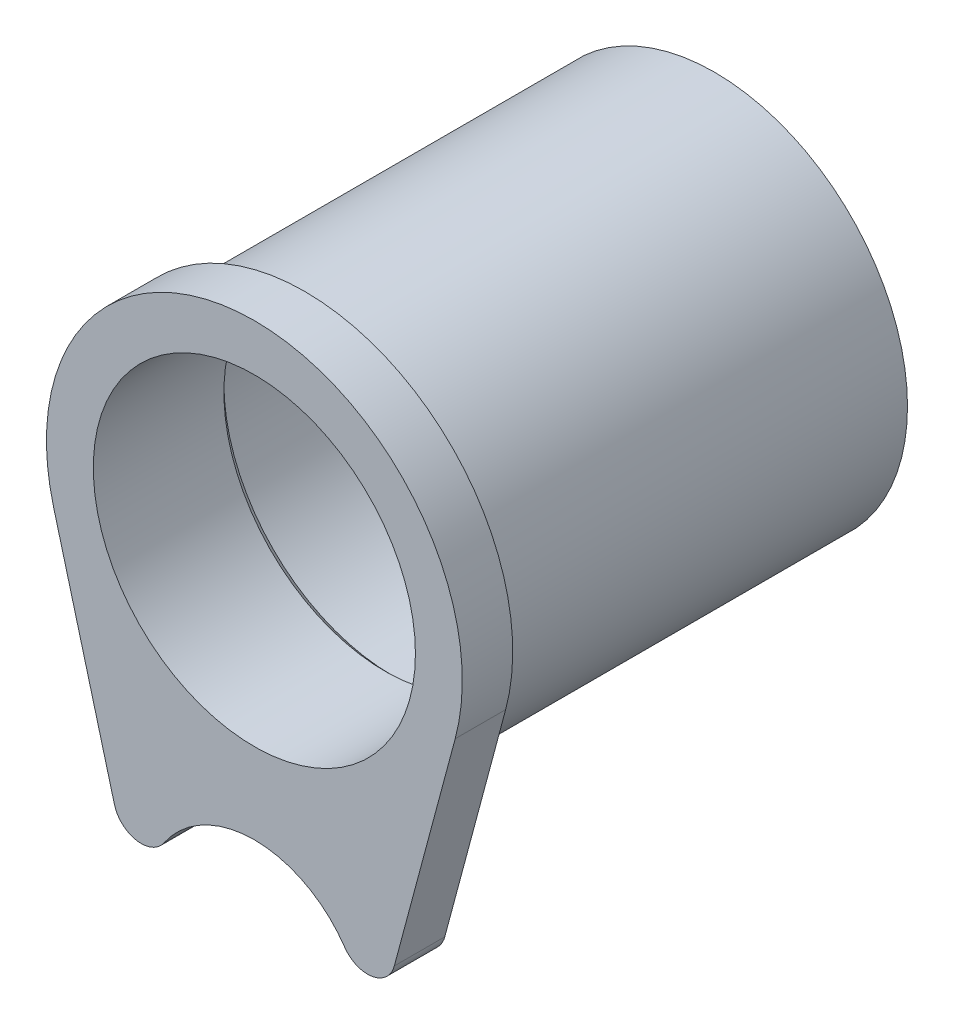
SolidWorks part; units mm, degrees
ref_plane "Front Plane" through (0, 0, 0) normal (0, 0, 1) x (1, 0, 0)
ref_plane "Top Plane" through (0, 0, 0) normal (0, 1, 0) x (1, 0, 0)
ref_plane "Right Plane" through (0, 0, 0) normal (1, 0, 0) x (0, 0, -1)
sketch "Sketch1" plane through (0, 0, 0) normal (0, 0, 1) x (1, 0, 0)
  circle A0 centre (0, 0) radius 8.8392
  dimension "D1" = 17.6784
extrude "Boss-Extrude1" add sketch "Sketch1" against normal blind 21.082
sketch "Sketch2" plane through (0, 0, -21.082) normal (0, 0, -1) x (-1, 0, 0)
  circle A0 centre (0, 0) radius 7.747
  dimension "D1" = 15.494
extrude "Cut-Extrude1" cut sketch "Sketch2" against normal blind 14.732
sketch "Sketch3" plane through (0, 0, -6.35) normal (0, 0, -1) x (-1, 0, 0)
  circle A0 centre (0, 0) radius 7.3787
  dimension "D1" = 14.7574
extrude "Cut-Extrude2" cut sketch "Sketch3" against normal blind 14.732
sketch "Sketch4" plane through (0, 0, 0) normal (0, 0, 1) x (1, 0, 0)
  line L0 (0, 13.4567) -> (0, -21.1312) construction
  line L1 (9.861, 0) -> (-13.8788, 0) construction
  line L2 (-9.2004, -2.4653) -> (-6.4114, -12.8742)
  line L3 (6.4114, -12.8742) -> (9.2004, -2.4653)
  line L4 (-12.7089, -11.0744) -> (-6.8936, -11.0744) construction
  line L5 (6.8936, -11.0744) -> (9.0775, -11.0744) construction
  arc A0 (9.2004, -2.4653) -> (-9.2004, -2.4653) centre (0, 0) ccw
  arc A1 (4.1351, -13.2606) -> (-4.1351, -13.2606) centre (0, -16.0782) ccw
  arc A2 (-6.4114, -12.8742) -> (-4.1351, -13.2606) centre (-5.1846, -12.5455) ccw
  arc A3 (4.1351, -13.2606) -> (6.4114, -12.8742) centre (5.1846, -12.5455) ccw
  circle A4 centre (0, 0) radius 7.3787
  dimension "D1" = 19.05
  dimension "D4" = 10.0076
  dimension "D5" = 2.54
  dimension "D2" = 30
  dimension "D3" = 11.0744
extrude "Boss-Extrude2" add sketch "Sketch4" against normal blind 2.3114
sketch "Sketch5" plane through (0, 0, 0) normal (1, 0, 0) x (0, 0, -1)
  line L0 (6.35, -7.747) -> (6.35, 7.747) construction
  line L1 (6.35, -7.747) -> (6.35, -7.3787)
  line L2 (0, -7.3787) -> (6.35, -7.3787) construction
  line L3 (5.9817, -7.3787) -> (6.35, -7.3787)
  line L4 (6.35, -7.747) -> (5.9817, -7.3787)
  line L5 (0, 0) -> (12.8494, 0) construction
revolve "Cut-Revolve1" cut sketch "Sketch5" angle 360 about L5
fillet "Fillet1" radius 0.381 1 edges at (8.8392, 0, -2.3114)
sketch "Sketch6" plane through (0, 0, -2.3114) normal (0, 0, -1) x (-1, 0, 0)
  line L0 (0, 0) -> (0, -20.404) construction
  line L1 (0, 0) -> (9.7596, -2.4333) construction
  line L2 (0, 0) -> (2.9744, -16.8689) construction
  line L3 (9.2004, -2.4653) -> (6.4114, -12.8742) construction
  line L4 (8.5549, -4.8746) -> (8.3639, -5.5871)
  arc A0 (8.5766, -2.1384) -> (8.5549, -4.8746) centre (14.2451, -3.5517) ccw
  arc A1 (4.5512, -8.9698) -> (1.5349, -8.7049) centre (2.5494, -14.4582) ccw
  circle A2 centre (0, 0) radius 8.8392 construction
  arc A3 (1.5349, -8.7049) -> (8.5766, -2.1384) centre (0, 0) ccw
  arc A4 (4.5512, -8.9698) -> (8.3639, -5.5871) centre (0, 0) ccw
  dimension "D3" = 11.684
  dimension "D4" = 20.1168
  dimension "D1" = 76
  dimension "D2" = 66
extrude "Boss-Extrude3" add sketch "Sketch6" along normal blind 2.8448 from offset 2.921
